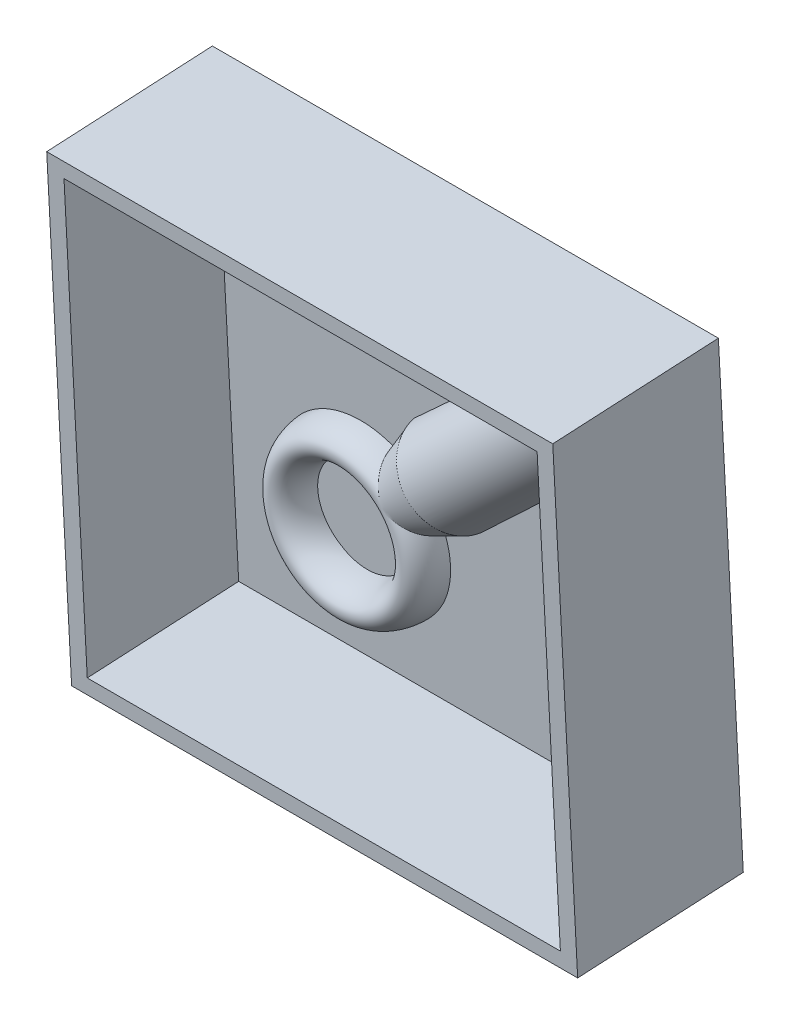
SolidWorks part; units mm, degrees
ref_plane "Alzado" through (0, 0, 0) normal (0, 0, 1) x (1, 0, 0)
ref_plane "Planta" through (0, 0, 0) normal (0, 1, 0) x (1, 0, 0)
ref_plane "Vista lateral" through (0, 0, 0) normal (1, 0, 0) x (0, 0, -1)
imported_body "Sólido importado1"
sketch "Croquis3" plane through (0, 0, 0) normal (0, 0, 1) x (1, 0, 0)
  line L0 (-43.895, -28.6651) -> (17.3155, -28.6651) construction
ref_plane "Plano2" through (0, -0.0785, 1.4982) normal (0, -0.0523, 0.9986) x (1, 0, 0)
sketch "Croquis4" plane through (0, -0.0785, 1.4982) normal (0, -0.0523, 0.9986) x (1, 0, 0)
  line L1 (-53.3969, -50.1958) -> (53.3969, -50.1958)
  line L2 (-53.3969, -50.1958) -> (-53.3969, 50.1958)
  line L3 (-53.3969, 50.1958) -> (53.3969, 50.1958)
  line L4 (53.3969, -50.1958) -> (53.3969, 50.1958)
  line L5 (-53.3969, -50.1958) -> (53.3969, 50.1958) construction
  line L6 (-53.3969, 50.1958) -> (53.3969, -50.1958) construction
  point P0 (0, 0)
extrude "Saliente-Extruir1" add sketch "Croquis4" against normal blind 3
sketch "Croquis5" plane through (0, -0.0785, 1.4982) normal (0, -0.0523, 0.9986) x (1, 0, 0)
  line L1 (-53.3969, 50.1958) -> (53.3969, 50.1958)
  line L2 (-53.3969, 50.1958) -> (-53.3969, -50.1958)
  line L3 (-53.3969, -50.1958) -> (53.3969, -50.1958)
  line L4 (53.3969, 50.1958) -> (53.3969, -50.1958)
  line L5 (-53.3969, 50.1958) -> (53.3969, -50.1958) construction
  line L6 (-53.3969, -50.1958) -> (53.3969, 50.1958) construction
  line L7 (-49.9226, 46.9298) -> (49.9226, 46.9298)
  line L8 (-49.9226, 46.9298) -> (-49.9226, -46.9298)
  line L9 (-49.9226, -46.9298) -> (49.9226, -46.9298)
  line L10 (49.9226, 46.9298) -> (49.9226, -46.9298)
  line L11 (-49.9226, 46.9298) -> (49.9226, -46.9298) construction
  line L12 (-49.9226, -46.9298) -> (49.9226, 46.9298) construction
  point P0 (0, 0)
  point P7 (0, 0)
extrude "Saliente-Extruir2" add sketch "Croquis5" along normal blind 32 contours L2 L1 L4 L3 | L8 L7 L10 L9
